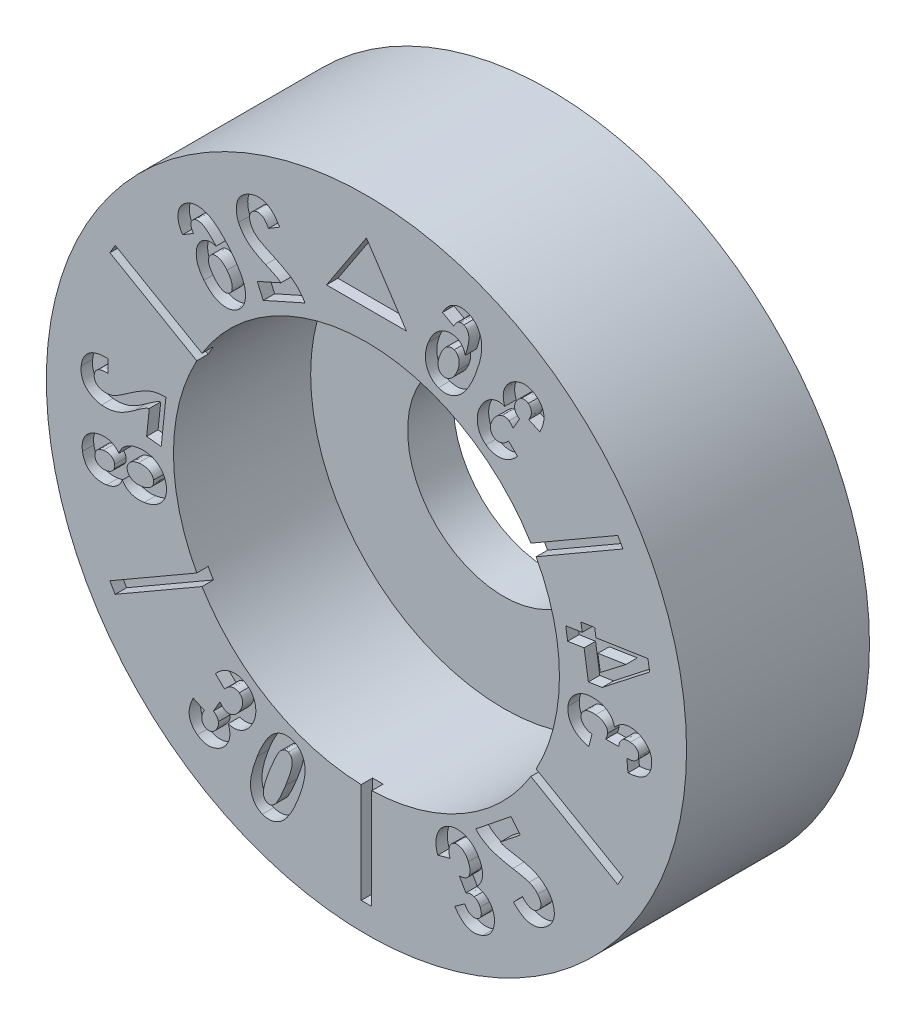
SolidWorks part; units mm, degrees
ref_plane "Front Plane" through (0, 0, 0) normal (0, 0, 1) x (1, 0, 0)
ref_plane "Top Plane" through (0, 0, 0) normal (0, 1, 0) x (1, 0, 0)
ref_plane "Right Plane" through (0, 0, 0) normal (1, 0, 0) x (0, 0, -1)
sketch "Sketch4" plane through (0, 0, 0) normal (0, 0, 1) x (1, 0, 0)
  circle A0 centre (0, 0) radius 7
  dimension "D1" = 14
extrude "Boss-Extrude2" add sketch "Sketch4" against normal blind 4
sketch "Sketch5" plane through (0, 0, 0) normal (0, 0, 1) x (1, 0, 0)
  circle A0 centre (0, 0) radius 4.22
  dimension "D1" = 8.44
extrude "Cut-Extrude2" cut sketch "Sketch5" against normal blind 3
sketch "Sketch6" plane through (0, 0, -3) normal (0, 0, 1) x (1, 0, 0)
  circle A0 centre (0, 0) radius 2.1
  dimension "D1" = 4.2
extrude "Cut-Extrude3" cut sketch "Sketch6" against normal through all
sketch "Sketch1" plane through (0, 0, 0) normal (0, 0, 1) x (1, 0, 0)
  line L6 (0.8741, 4.8653) -> (0, 6.192)
  line L7 (0, 6.192) -> (-0.8741, 4.8653)
  line L8 (-0.8741, 4.8653) -> (0.8741, 4.8653)
sketch "Sketch2" plane through (0, 0, 0) normal (0, 0, 1) x (1, 0, 0)
  line L0 (0, 0) -> (0, -7.6937) construction
  line L1 (0, 0) -> (-3.8469, -6.663) construction
  line L2 (-0.115, -3.1) -> (0.115, -3.1)
  line L3 (-0.115, -3.1) -> (-0.115, -6.4114)
  line L4 (-0.115, -6.4114) -> (0.115, -6.4114)
  line L6 (0.115, -3.1) -> (0.115, -6.4114)
  line L11 (0, 0) -> (-6.663, -3.8469) construction
  line L12 (-2.6272, -1.6496) -> (-5.4949, -3.3053)
  line L13 (-2.7422, -1.4504) -> (-2.6272, -1.6496)
  line L14 (-2.7422, -1.4504) -> (-5.6099, -3.1061)
  line L15 (-5.6099, -3.1061) -> (-5.4949, -3.3053)
  line L16 (0, 0) -> (-7.6937, 0) construction
  line L21 (0, 0) -> (-6.663, 3.8469) construction
  line L22 (-2.7422, 1.4504) -> (-5.6099, 3.1061)
  line L23 (-2.6272, 1.6496) -> (-2.7422, 1.4504)
  line L24 (-2.6272, 1.6496) -> (-5.4949, 3.3053)
  line L25 (-5.4949, 3.3053) -> (-5.6099, 3.1061)
  line L26 (0, 0) -> (-3.8469, 6.663) construction
  line L31 (0, 0) -> (0, 7.6937) construction
  line L36 (0, 0) -> (3.8469, 6.663) construction
  line L41 (0, 0) -> (6.663, 3.8469) construction
  line L42 (2.6272, 1.6496) -> (5.4949, 3.3053)
  line L43 (2.7422, 1.4504) -> (2.6272, 1.6496)
  line L44 (2.7422, 1.4504) -> (5.6099, 3.1061)
  line L45 (5.6099, 3.1061) -> (5.4949, 3.3053)
  line L46 (0, 0) -> (7.6937, 0) construction
  line L51 (0, 0) -> (6.663, -3.8469) construction
  line L52 (2.7422, -1.4504) -> (5.6099, -3.1061)
  line L53 (2.6272, -1.6496) -> (2.7422, -1.4504)
  line L54 (2.6272, -1.6496) -> (5.4949, -3.3053)
  line L55 (5.4949, -3.3053) -> (5.6099, -3.1061)
  line L56 (0, 0) -> (3.8469, -6.663) construction
  line L61 (0.115, 6.4114) -> (-0.115, 6.4114)
  line L62 (0.115, 3.1) -> (0.115, 6.4114)
  line L63 (-0.115, 3.1) -> (-0.115, 6.4114)
  line L64 (0.115, 3.1) -> (-0.115, 3.1)
  line L65 (1.6496, 2.6272) -> (3.3053, 5.4949)
  line L66 (3.3053, 5.4949) -> (3.1061, 5.6099)
  line L67 (1.4504, 2.7422) -> (3.1061, 5.6099)
  line L68 (1.6496, 2.6272) -> (1.4504, 2.7422)
  line L69 (-1.6496, 2.6272) -> (-3.3053, 5.4949)
  line L70 (-1.4504, 2.7422) -> (-3.1061, 5.6099)
  line L71 (-3.1061, 5.6099) -> (-3.3053, 5.4949)
  line L72 (-1.4504, 2.7422) -> (-1.6496, 2.6272)
  line L73 (-3.1, 0.115) -> (-6.4114, 0.115)
  line L74 (-3.1, -0.115) -> (-6.4114, -0.115)
  line L75 (3.1, 0.115) -> (6.4114, 0.115)
  line L76 (3.1, -0.115) -> (6.4114, -0.115)
  line L77 (6.4114, -0.115) -> (6.4114, 0.115)
  line L78 (3.1, -0.115) -> (3.1, 0.115)
  line L79 (-3.1, 0.115) -> (-3.1, -0.115)
  line L80 (-6.4114, 0.115) -> (-6.4114, -0.115)
  line L81 (-1.6496, -2.6272) -> (-3.3053, -5.4949)
  line L82 (-1.4504, -2.7422) -> (-3.1061, -5.6099)
  line L83 (-3.3053, -5.4949) -> (-3.1061, -5.6099)
  line L84 (-1.6496, -2.6272) -> (-1.4504, -2.7422)
  line L85 (1.6496, -2.6272) -> (3.3053, -5.4949)
  line L86 (1.4504, -2.7422) -> (3.1061, -5.6099)
  line L87 (1.4504, -2.7422) -> (1.6496, -2.6272)
  line L88 (3.1061, -5.6099) -> (3.3053, -5.4949)
  arc A0 (-1.2968, 4.3091) -> (0, 4.5) centre (0, 0) ccw construction
  text T0 "26    28    30    32    34    36" font "Arial Narrow" height 1.8
  point P67 (0, 0)
  dimension "D1" = 9
  dimension "D6" = 12
extrude "Cut-Extrude1" cut sketch "Sketch2" against normal blind 0.25
extrude "Cut-Extrude4" cut sketch "Sketch1" against normal blind 0.25
sketch "Sketch7" plane through (0, 0, 0) normal (0, 1, 0) x (1, 0, 0)
  line L0 (7, 4) -> (-7, 4) construction
  line L1 (-4.5, 4) -> (-5.5, 4)
  arc A0 (-5.5, 4) -> (-4.5, 4) centre (-5, 4) cw
  dimension "D2" = 0.5
  dimension "D1" = 5
revolve "Revolve1" add sketch "Sketch7" angle 360 about L1
